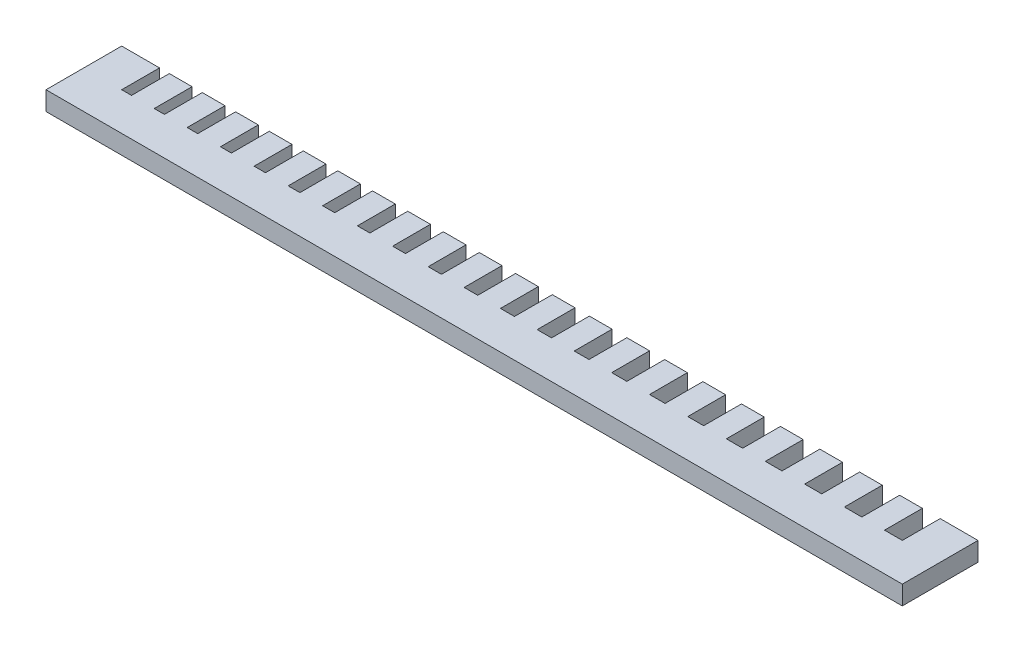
SolidWorks part; units mm, degrees
ref_plane "Alzado" through (0, 0, 0) normal (0, 0, 1) x (1, 0, 0)
ref_plane "Planta" through (0, 0, 0) normal (0, 1, 0) x (1, 0, 0)
ref_plane "Vista lateral" through (0, 0, 0) normal (1, 0, 0) x (0, 0, -1)
sketch "Croquis2" plane through (0, 0, 0) normal (0, 1, 0) x (1, 0, 0)
  line L1 (0, 0) -> (226.3, 0)
  line L2 (0, 0) -> (0, 40)
  line L3 (0, 40) -> (226.3, 40)
  line L4 (226.3, 0) -> (226.3, 40)
  dimension "D1" = 40
  dimension "D2" = 226.3
extrude "Saliente-Extruir2" add sketch "Croquis2" along normal blind 5 contours L3 L4 L1 L2
sketch "Croquis1" plane through (0, 0, 0) normal (0, 1, 0) x (1, 0, 0)
  line L0 (18.6, 20) -> (18.6, 10)
  line L1 (0, 0) -> (246.3, 0) construction
  line L2 (0, 0) -> (0, 20) construction
  line L3 (0, 20) -> (10, 20)
  line L4 (246.3, 0) -> (246.3, 20.0027) construction
  line L6 (10, 20) -> (10, 10)
  line L7 (10, 10) -> (12.6, 10)
  line L8 (12.6, 20) -> (12.6, 10)
  line L10 (21.3, 20) -> (21.3, 10)
  line L11 (18.6, 10) -> (21.3, 10)
  line L12 (27.3, 20) -> (27.3, 10)
  line L14 (30.1, 20) -> (30.1, 10)
  line L15 (27.3, 10) -> (30.1, 10)
  line L16 (36.1, 20) -> (36.1, 10)
  line L18 (39, 20) -> (39, 10)
  line L19 (36.1, 10) -> (39, 10)
  line L20 (45, 20) -> (45, 10)
  line L22 (48, 20) -> (48, 10)
  line L23 (45, 10) -> (48, 10)
  line L24 (54, 20) -> (54, 10)
  line L26 (57.1, 20) -> (57.1, 10)
  line L27 (54, 10) -> (57.1, 10)
  line L28 (63.1, 20) -> (63.1, 10)
  line L30 (66.3, 20) -> (66.3, 10)
  line L31 (63.1, 10) -> (66.3, 10)
  line L32 (72.3, 20) -> (72.3, 10)
  line L34 (75.6, 20) -> (75.6, 10)
  line L35 (72.3, 10) -> (75.6, 10)
  line L36 (81.6, 20) -> (81.6, 10)
  line L38 (85, 20) -> (85, 10)
  line L39 (81.6, 10) -> (85, 10)
  line L40 (91, 20) -> (91, 10)
  line L42 (94.5, 20) -> (94.5, 10)
  line L43 (91, 10) -> (94.5, 10)
  line L44 (100.5, 20) -> (100.5, 10)
  line L46 (104.1, 20) -> (104.1, 10)
  line L47 (100.5, 10) -> (104.1, 10)
  line L48 (110.1, 20) -> (110.1, 10)
  line L50 (113.8, 20) -> (113.8, 10)
  line L51 (110.1, 10) -> (113.8, 10)
  line L52 (119.8, 20) -> (119.8, 10)
  line L54 (123.6, 20) -> (123.6, 10)
  line L55 (119.8, 10) -> (123.6, 10)
  line L56 (129.6, 20) -> (129.6, 10)
  line L58 (133.5, 20) -> (133.5, 10)
  line L59 (129.6, 10) -> (133.5, 10)
  line L60 (139.5, 20) -> (139.5, 10)
  line L62 (143.5, 20) -> (143.5, 10)
  line L63 (139.5, 10) -> (143.5, 10)
  line L64 (149.5, 20) -> (149.5, 10)
  line L66 (153.6, 20) -> (153.6, 10)
  line L67 (149.5, 10) -> (153.6, 10)
  line L68 (159.6, 20) -> (159.6, 10)
  line L70 (163.8, 20) -> (163.8, 10)
  line L71 (159.6, 10) -> (163.8, 10)
  line L72 (169.8, 20) -> (169.8, 10)
  line L74 (174.1, 20) -> (174.1, 10)
  line L75 (169.8, 10) -> (174.1, 10)
  line L76 (180.1, 20) -> (180.1, 10)
  line L78 (184.5, 20) -> (184.5, 10)
  line L79 (180.1, 10) -> (184.5, 10)
  line L80 (190.5, 20) -> (190.5, 10)
  line L82 (195, 20) -> (195, 10)
  line L83 (190.5, 10) -> (195, 10)
  line L84 (201, 20) -> (201, 10)
  line L86 (205.6, 20) -> (205.6, 10)
  line L87 (201, 10) -> (205.6, 10)
  line L88 (211.6, 20) -> (211.6, 10)
  line L90 (216.3, 20.0027) -> (216.3, 10)
  line L91 (211.6, 10) -> (216.3, 10)
  line L92 (21.3, 20) -> (27.3, 20)
  line L93 (0, 20) -> (0, 40)
  line L94 (12.6, 20) -> (18.6, 20)
  line L95 (30.1, 20) -> (36.1, 20)
  line L96 (39, 20) -> (45, 20)
  line L97 (48, 20) -> (54, 20)
  line L98 (57.1, 20) -> (63.1, 20)
  line L99 (66.3, 20) -> (72.3, 20)
  line L100 (75.6, 20) -> (81.6, 20)
  line L101 (85, 20) -> (91, 20)
  line L102 (94.5, 20) -> (100.5, 20)
  line L103 (104.1, 20) -> (110.1, 20)
  line L104 (113.8, 20) -> (119.8, 20)
  line L105 (123.6, 20) -> (129.6, 20)
  line L106 (133.5, 20) -> (139.5, 20)
  line L107 (143.5, 20) -> (149.5, 20)
  line L108 (153.6, 20) -> (159.6, 20)
  line L109 (163.8, 20) -> (169.8, 20)
  line L110 (174.1, 20) -> (180.1, 20)
  line L111 (184.5, 20) -> (190.5, 20)
  line L112 (195, 20) -> (201, 20)
  line L113 (205.6, 20) -> (211.6, 20)
  line L115 (0, 40) -> (246.3, 40)
  line L116 (246.3, 40) -> (246.3, 20.0027)
  line L117 (216.3, 20.0027) -> (246.3, 20.0027)
  dimension "D1" = 30
  dimension "D2" = 10
  dimension "D3" = 20
  dimension "D4" = 6
  dimension "D5" = 10
  dimension "A" = 2.6
  dimension "B" = 2.7
  dimension "C" = 2.8
  dimension "D" = 2.9
  dimension "E" = 3
  dimension "F" = 3.1
  dimension "G" = 3.2
  dimension "H" = 3.3
  dimension "I" = 3.4
  dimension "J" = 3.5
  dimension "K" = 3.6
  dimension "L" = 3.7
  dimension "M" = 3.8
  dimension "N" = 3.9
  dimension "O" = 4
  dimension "P" = 4.1
  dimension "Q" = 4.2
  dimension "R" = 4.3
  dimension "S" = 4.4
  dimension "T" = 4.5
  dimension "U" = 4.6
  dimension "V" = 4.7
extrude "Cortar-Extruir1" cut sketch "Croquis1" along normal blind 5
